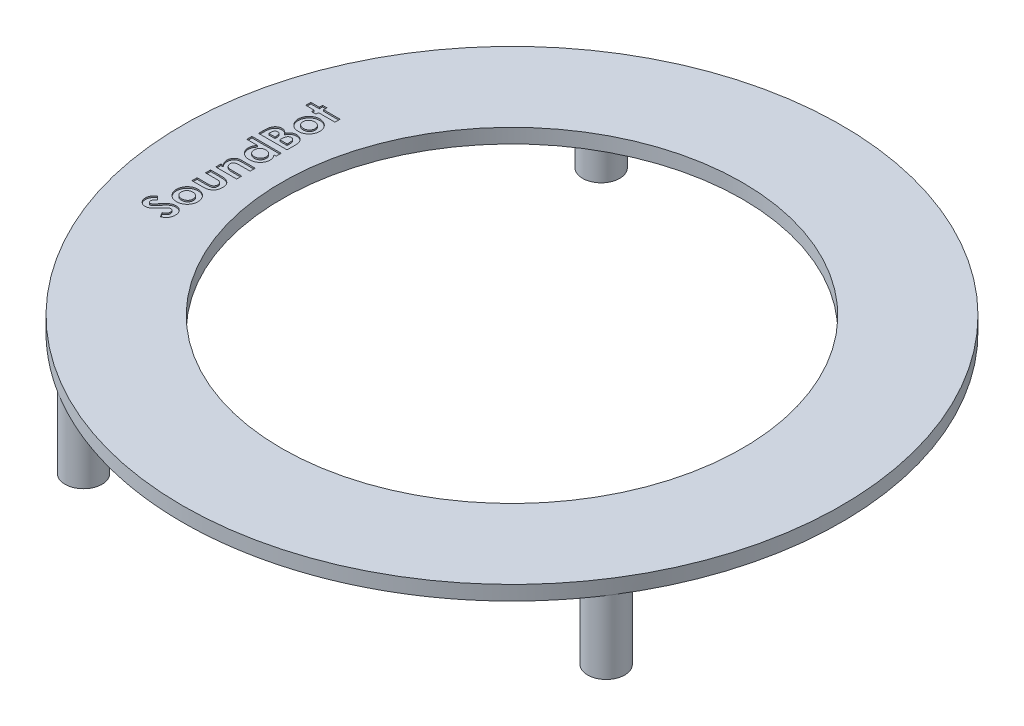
SolidWorks part; units mm, degrees
ref_plane "Front Plane" through (0, 0, 0) normal (0, 0, 1) x (1, 0, 0)
ref_plane "Top Plane" through (0, 0, 0) normal (0, 1, 0) x (1, 0, 0)
ref_plane "Right Plane" through (0, 0, 0) normal (1, 0, 0) x (0, 0, -1)
sketch "Sketch1" plane through (0, 0, 0) normal (0, 1, 0) x (1, 0, 0)
  circle A0 centre (0, 0) radius 29.337
  circle A1 centre (0, 0) radius 20.5105
  dimension "D1" = 58.674
  dimension "D2" = 41.021
extrude "Boss-Extrude1" add sketch "Sketch1" along normal blind 1.2827
sketch "Sketch2" plane through (0, 0, 0) normal (0, -1, 0) x (1, 0, 0)
  line L0 (23.3144, 14.9317) -> (-14.6594, 23.4865) construction
  line L1 (23.3144, 14.9317) -> (15.2019, -23.1391) construction
  line L2 (15.2019, -23.1391) -> (-15.2019, -23.1391) construction
  circle A0 centre (23.3144, 14.9317) radius 1.651
  circle A1 centre (15.2019, -23.1391) radius 1.651
  circle A2 centre (-15.2019, -23.1391) radius 1.651
  circle A3 centre (-14.6594, 23.4865) radius 1.651
  circle A4 centre (0, 0) radius 29.337 construction
  circle A5 centre (-14.6594, 23.4865) radius 0.762
  circle A6 centre (23.3144, 14.9317) radius 0.762
  circle A7 centre (-15.2019, -23.1391) radius 0.762
  circle A8 centre (15.2019, -23.1391) radius 0.762
  dimension "D1" = 3.302
  dimension "D4" = 1.524
  dimension "D2" = 38.9255
  dimension "D3" = 30.4038
extrude "Boss-Extrude2" add sketch "Sketch2" along normal blind 6.5024
sketch "Sketch3" plane through (0, 1.2827, 0) normal (0, 1, 0) x (1, 0, 0)
  line L0 (-22.7773, -8.1562) -> (-22.7773, 8.1562) construction
  line L1 (-22.7773, 0) -> (0, 0) construction
  text T0 "<b>SoundBot</b>" font "Century Gothic" height 2.54
  point P6 (0, 0)
extrude "Cut-Extrude3" cut sketch "Sketch3" against normal blind 0.127
